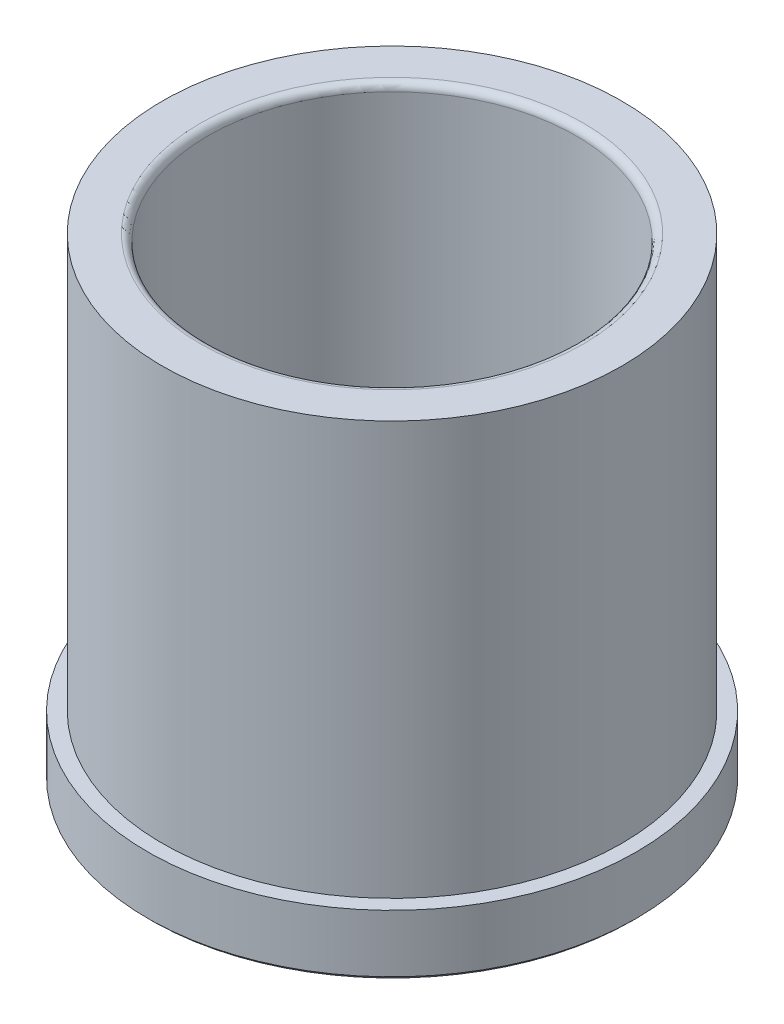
SolidWorks part; units mm, degrees
ref_plane "Front Plane" through (0, 0, 0) normal (0, 0, 1) x (1, 0, 0)
ref_plane "Top Plane" through (0, 0, 0) normal (0, 1, 0) x (1, 0, 0)
ref_plane "Right Plane" through (0, 0, 0) normal (1, 0, 0) x (0, 0, -1)
sketch "Sketch1" plane through (0, 0, 0) normal (0, 0, 1) x (1, 0, 0)
  line L0 (-49.911, 0) -> (-50.673, 0.762)
  line L1 (0, -1000) -> (0, 49000) construction
  line L2 (-38.1635, 98.425) -> (-38.1635, 0.762)
  line L3 (-38.9255, 0) -> (-49.911, 0)
  line L4 (-50.673, 0.762) -> (-50.673, 12.7)
  line L5 (-50.673, 12.7) -> (-47.6313, 12.7)
  line L6 (-47.6313, 98.425) -> (-47.6313, 12.7)
  line L7 (-47.6313, 98.425) -> (-38.1635, 98.425)
  line L8 (-38.9255, 0) -> (-38.1635, 0.762)
  dimension "OD" = 95.2627
  dimension "ID" = 76.327
  dimension "H" = 101.346
  dimension "D2" = 45
  dimension "OVERALL LENGTH" = 98.425
  dimension "D4" = 0.762
  dimension "D5" = 135
  dimension "T" = 12.7
revolve "Revolve1" add sketch "Sketch1" angle 360 about L1
fillet "Fillet1" radius 1.524 1 edges at (38.1635, 98.425, 0)
